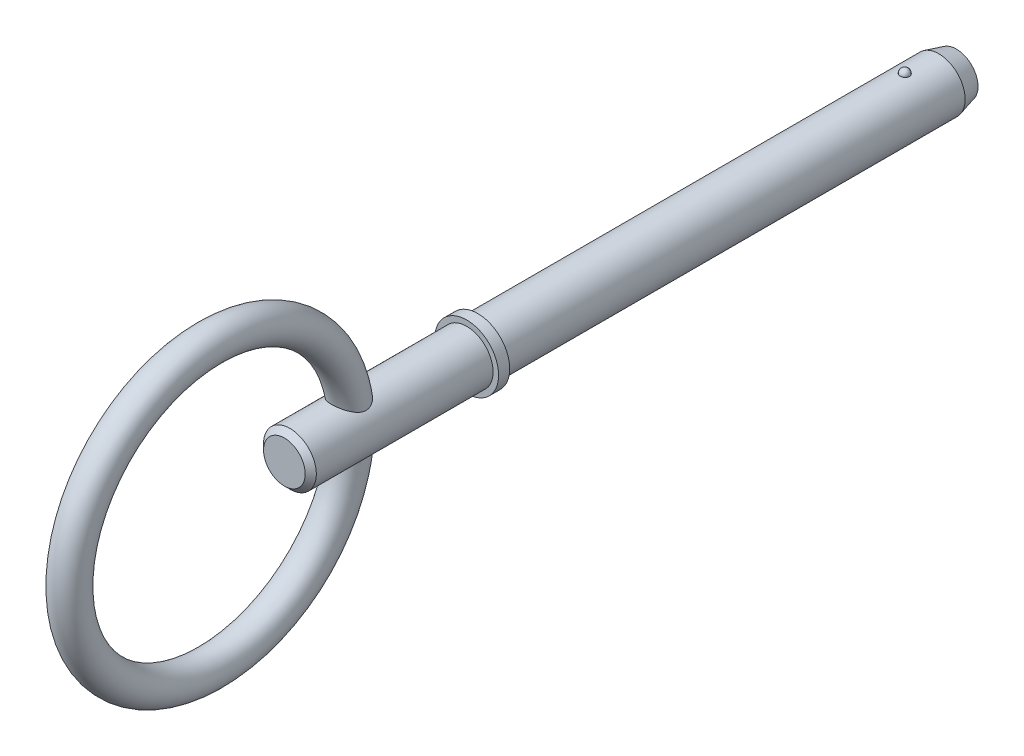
SolidWorks part; units mm, degrees
ref_plane "Front Plane" through (0, 0, 0) normal (0, 0, 1) x (1, 0, 0)
ref_plane "Top Plane" through (0, 0, 0) normal (0, 1, 0) x (1, 0, 0)
ref_plane "Right Plane" through (0, 0, 0) normal (1, 0, 0) x (0, 0, -1)
sketch "Sketch2" plane through (0, 0, 0) normal (0, 0, 1) x (1, 0, 0)
  circle A0 centre (0, 0) radius 2.38
  point P3 (0, 2.38)
  dimension "D1" = 4.76
extrude "Boss-Extrude1" add sketch "Sketch2" along normal blind 38.1
sketch "Sketch3" plane through (0, 0, 0) normal (0, 0, -1) x (-1, 0, 0)
  circle A0 centre (0, 0) radius 2.38
  dimension "D1" = 4.76
extrude "Boss-Extrude2" add sketch "Sketch3" along normal blind 5.08
chamfer "Chamfer1" distance 1.586 angle 15 1 edges at (-2.38, 0, -5.08)
sketch "Sketch18" plane through (0, 0, 0) normal (1, 0, 0) x (0, 0, -1)
  line L0 (3.494, 2.38) -> (-38.1, 2.38) construction
  line L1 (0.42, 2.8) -> (0.42, 1.96)
  line L2 (-38.1, -2.38) -> (3.494, -2.38) construction
  arc A0 (0.42, 2.8) -> (0.42, 1.96) centre (0.42, 2.38) ccw
  point P4 (0, 2.38)
  dimension "D1" = 5.18
revolve "Revolve1" add sketch "Sketch18" angle 360 about L1
sketch "Sketch19" plane through (0, 0, 0) normal (1, 0, 0) x (0, 0, -1)
  line L0 (-33.7288, 0) -> (-46.4542, 0) construction
sketch "Sketch20" plane through (0, 0, 0) normal (1, 0, 0) x (0, 0, -1)
  line L0 (-38.1, 0) -> (-38.1, 2.88)
  line L1 (-38.1, 2.38) -> (-38.1, -2.38) construction
  line L2 (-38.1, 2.88) -> (-39.1, 2.88)
  line L3 (-39.1, 2.88) -> (-39.1, 0)
  line L4 (-33.7288, 0) -> (-46.4542, 0) construction
  line L5 (-39.1, 0) -> (-38.1, 0)
  dimension "D1" = 2.88
  dimension "D2" = 1
revolve "Revolve2" add sketch "Sketch20" angle 360 about L0
sketch "Sketch21" plane through (0, 0, 38.1) normal (0, 0, -1) x (-1, 0, 0)
  circle A0 centre (0, 0) radius 2.38
  dimension "D1" = 4.76
extrude "Boss-Extrude3" add sketch "Sketch21" against normal blind 17.45
chamfer "Chamfer2" distance 0.5 angle 45 1 edges at (-2.38, 0, 55.55)
sketch "Sketch23" plane through (0, 0, 0) normal (1, 0, 0) x (0, 0, -1)
  line L0 (-55.55, 1.88) -> (-55.55, -1.88) construction
  circle A0 centre (-62.25, 0) radius 12.7
  point P2 (-49.55, 0)
  dimension "D1" = 25.4
  dimension "D2" = 6
sketch "Sketch24" plane through (0, 0, 0) normal (0, 1, 0) x (1, 0, 0)
  circle A0 centre (0, -49.55) radius 1.5
  dimension "D1" = 3
sweep "Sweep1" add profiles "Sketch24" path "Sketch23"
